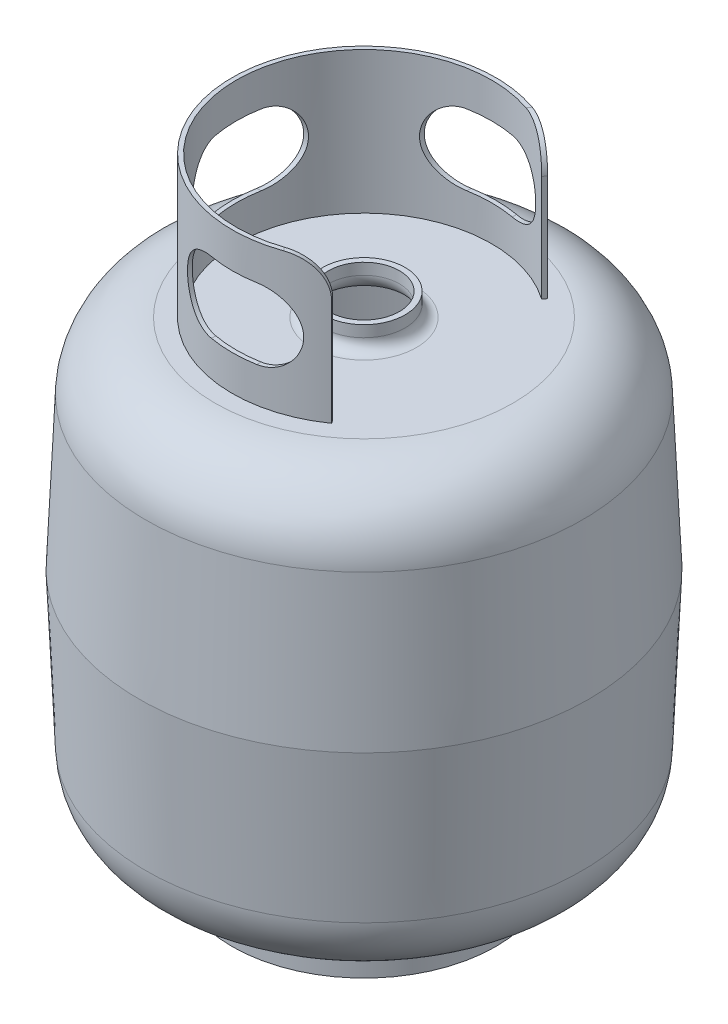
SolidWorks part; units mm, degrees
ref_plane "Alzado" through (0, 0, 0) normal (0, 0, 1) x (1, 0, 0)
ref_plane "Planta" through (0, 0, 0) normal (0, 1, 0) x (1, 0, 0)
ref_plane "Vista lateral" through (0, 0, 0) normal (1, 0, 0) x (0, 0, -1)
sketch "Croquis2" plane through (0, 0, 0) normal (0, 0, 1) x (1, 0, 0)
  line L0 (0, 0) -> (0, -320) construction
  line L1 (0, -320) -> (105.0428, -320)
  line L2 (150, -276.9629) -> (154.6701, -170)
  line L3 (154.6701, -170) -> (150, -63.0371)
  line L4 (105.0428, -20) -> (37, -20)
  line L5 (25, -8) -> (25, 0)
  line L14 (0, -324) -> (105.0428, -324)
  line L15 (153.9962, -277.1373) -> (158.6739, -170)
  line L16 (158.6739, -170) -> (153.9962, -62.8627)
  line L17 (105.0428, -16) -> (37, -16)
  line L18 (29, -8) -> (29, 0)
  line L20 (29, 0) -> (25, 0)
  line L21 (0, -320) -> (0, -324)
  line L22 (-105.0428, -324) -> (105.0428, -324) construction
  line L23 (-105.0428, -320) -> (105.0428, -320) construction
  line L24 (-150, -276.9629) -> (-154.6701, -170) construction
  line L25 (-153.9962, -277.1373) -> (-158.6739, -170) construction
  line L26 (-158.6739, -170) -> (-153.9962, -62.8627) construction
  line L27 (-154.6701, -170) -> (-150, -63.0371) construction
  line L28 (-105.0428, -20) -> (-37, -20) construction
  line L29 (-105.0428, -16) -> (-37, -16) construction
  line L30 (-29, -8) -> (-29, 0) construction
  line L31 (-25, -8) -> (-25, 0) construction
  arc A0 (105.0428, -320) -> (150, -276.9629) centre (105.0428, -275) ccw
  arc A1 (150, -63.0371) -> (105.0428, -20) centre (105.0428, -65) ccw
  arc A2 (37, -20) -> (25, -8) centre (37, -8) cw
  arc A9 (105.0428, -324) -> (153.9962, -277.1373) centre (105.0428, -275) ccw
  arc A10 (153.9962, -62.8627) -> (105.0428, -16) centre (105.0428, -65) ccw
  arc A11 (37, -16) -> (29, -8) centre (37, -8) cw
  arc A12 (-105.0428, -320) -> (-150, -276.9629) centre (-105.0428, -275) cw construction
  arc A13 (-105.0428, -324) -> (-153.9962, -277.1373) centre (-105.0428, -275) cw construction
  arc A14 (-153.9962, -62.8627) -> (-105.0428, -16) centre (-105.0428, -65) cw construction
  arc A15 (-150, -63.0371) -> (-105.0428, -20) centre (-105.0428, -65) cw construction
  arc A16 (-37, -20) -> (-25, -8) centre (-37, -8) ccw construction
  arc A17 (-37, -16) -> (-29, -8) centre (-37, -8) ccw construction
revolve "Revolución2" add sketch "Croquis2" angle 360 about L0
sketch "Croquis3" plane through (0, -16, 0) normal (0, 1, 0) x (1, 0, 0)
  line L0 (-132.7316, 0) -> (175.6241, 0) construction
  line L1 (0, 169.8345) -> (0, -199.0248) construction
  line L2 (0, 0) -> (75.9687, 108.4945) construction
  line L3 (0, 0) -> (104.9076, -149.8235) construction
  line L4 (53.3672, 76.2162) -> (51.6464, 73.7588)
  line L5 (51.6464, -73.7588) -> (53.3672, -76.2162)
  arc A0 (53.3672, 76.2162) -> (53.3672, -76.2162) centre (0, 0) ccw
  circle A1 centre (0, 0) radius 105.0428 construction
  arc A2 (51.6464, 73.7588) -> (51.6464, -73.7588) centre (0, 0) ccw
  dimension "D1" = 12
  dimension "D2" = 55
  dimension "D3" = 55
  dimension "D4" = 3
extrude "Saliente-Extruir1" add sketch "Croquis3" along normal blind 100
sketch "Croquis4" plane through (0, 0, 0) normal (0, 0, 1) x (1, 0, 0)
  line L0 (-16, 34) -> (16, 34) construction
  line L1 (-16, 59) -> (16, 59)
  line L2 (-16, 9) -> (16, 9)
  line L3 (51.6464, 84) -> (-90.0428, 84) construction
  arc A0 (-16, 59) -> (-16, 9) centre (-16, 34) ccw
  arc A1 (16, 9) -> (16, 59) centre (16, 34) ccw
  point P2 (0, 34)
  dimension "D2" = 25
  dimension "D4" = 0
  dimension "D1" = 32
  dimension "D3" = 50
extrude "Cortar-Extruir1" cut sketch "Croquis4" along normal through all and the other way through all
sketch "Croquis6" plane through (0, 0, 0) normal (1, 0, 0) x (0, 0, -1)
  line L0 (16, 34) -> (-16, 34) construction
  line L1 (16, 9) -> (-16, 9)
  line L2 (16, 59) -> (-16, 59)
  line L3 (93.0428, 84) -> (-93.0428, 84) construction
  arc A0 (16, 9) -> (16, 59) centre (16, 34) ccw
  arc A1 (-16, 59) -> (-16, 9) centre (-16, 34) ccw
  point P2 (0, 34)
  point P10 (0, 84)
  dimension "D3" = 25
  dimension "D1" = 32
  dimension "D2" = 0
  dimension "D4" = 50
extrude "Cortar-Extruir2" cut sketch "Croquis6" against normal through all
sketch "Croquis7" plane through (0, -324, 0) normal (0, -1, 0) x (1, 0, 0)
  circle A0 centre (0, 0) radius 93.0428
  circle A1 centre (0, 0) radius 105.0428 construction
  circle A2 centre (0, 0) radius 90.0428
  dimension "D1" = 12
  dimension "D2" = 3
extrude "Saliente-Extruir2" add sketch "Croquis7" along normal blind 30
fillet "Redondeo1" radius 25 1 edges at (52.5068, 84, 74.9875)
fillet "Redondeo2" radius 25 1 edges at (52.5068, 84, -74.9875)
equation "\"A\"=300"
equation "\"B\"= 300"
equation "\"D2@Croquis2\"=\"B\""
equation "\"D4@Croquis2\"=\"D3@Croquis2\""
equation "\"D10@Croquis2\"=\"B\"/2"
